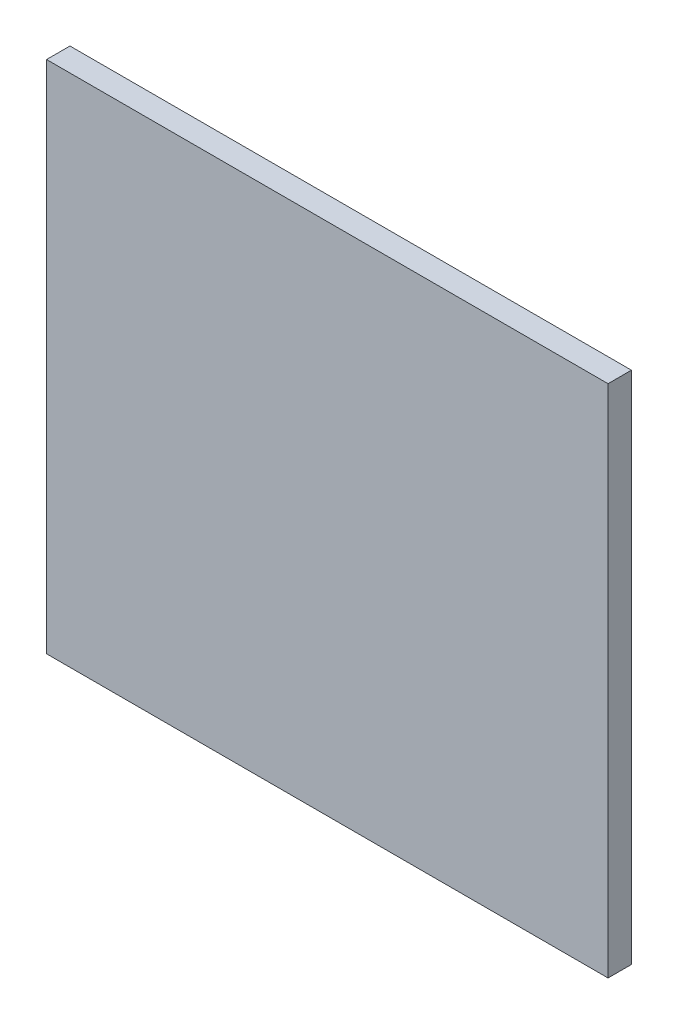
SolidWorks part; units mm, degrees
ref_plane "Front Plane" through (0, 0, 0) normal (0, 0, 1) x (1, 0, 0)
ref_plane "Top Plane" through (0, 0, 0) normal (0, 1, 0) x (1, 0, 0)
ref_plane "Right Plane" through (0, 0, 0) normal (1, 0, 0) x (0, 0, -1)
sketch "Sketch1" plane through (0, 0, 0) normal (0, 0, 1) x (1, 0, 0)
  line L1 (0, 0) -> (1219.2, 0)
  line L2 (0, 0) -> (0, 1117.6)
  line L3 (0, 1117.6) -> (1219.2, 1117.6)
  line L4 (1219.2, 0) -> (1219.2, 1117.6)
  dimension "D1" = 1219.2
  dimension "D2" = 1117.6
extrude "Boss-Extrude2" add sketch "Sketch1" along normal blind 50.8
